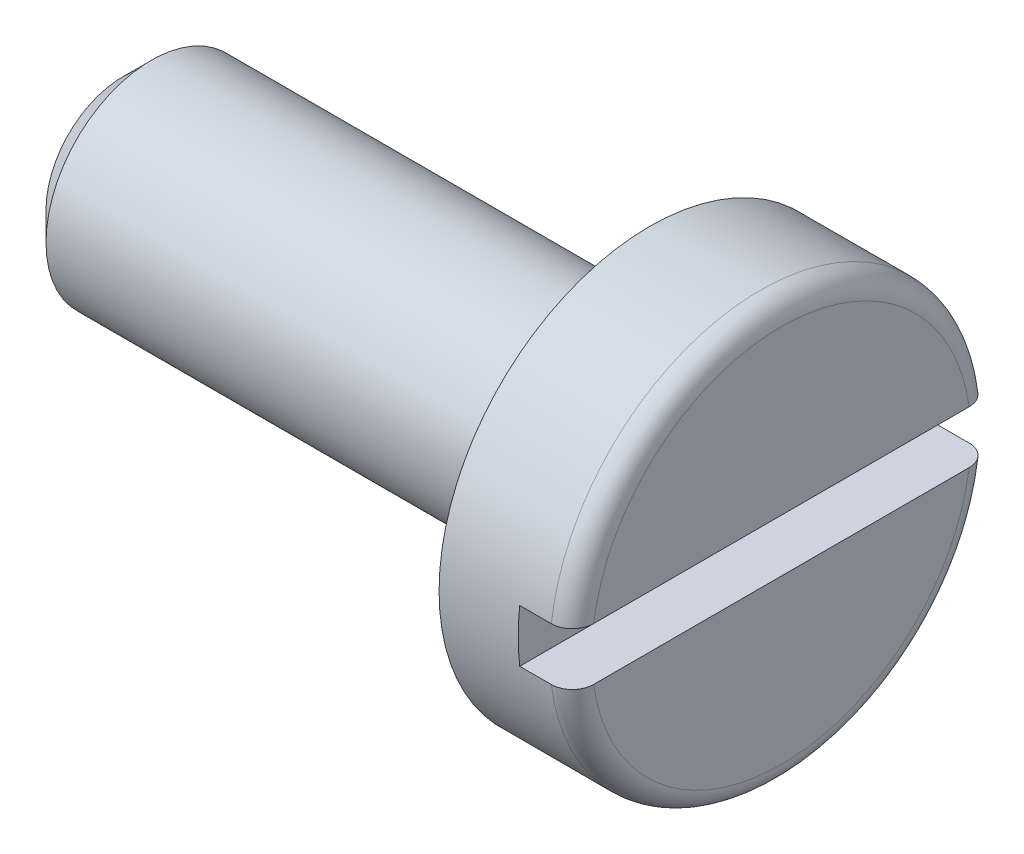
SolidWorks part; units mm, degrees
ref_plane "Plan de face" through (0, 0, 0) normal (0, 0, 1) x (1, 0, 0)
ref_plane "Plan de dessus" through (0, 0, 0) normal (0, 1, 0) x (1, 0, 0)
ref_plane "Plan de coté" through (0, 0, 0) normal (1, 0, 0) x (0, 0, -1)
sketch "Esquisse1" plane through (0, 0, 0) normal (0, 0, 1) x (1, 0, 0)
  line L0 (0, 0) -> (-17.1619, 0) construction
  line L1 (0, 0) -> (0, 1.44)
  line L2 (-0.16, 1.6) -> (-1, 1.6)
  line L3 (-1, 1.6) -> (-1, 0.8)
  line L4 (-1, 0.8) -> (-5, 0.8)
  line L5 (-5, 0.8) -> (-5, 0)
  line L6 (-5, 0) -> (0, 0)
  arc A0 (0, 1.44) -> (-0.16, 1.6) centre (-0.16, 1.44) ccw
  dimension "conge_tete" = 0.16
  dimension "diam_tete" = 3.2
  dimension "haut_tete" = 1
  dimension "longueur" = 4
  dimension "diametre" = 1.6
revolve "BaseRévolution" add sketch "Esquisse1" angle 360 about L0
chamfer "Chanfrein1" distance 0.2147 angle 45 1 edges at (-5, 0, -0.8)
sketch "Esquisse2" plane through (0, 0, 0) normal (1, 0, 0) x (0, 0, -1)
  line L0 (-1.6, 0.2) -> (1.6, 0.2)
  line L1 (-1.6, 0.2) -> (-1.6, -0.2)
  line L2 (1.6, -0.2) -> (-1.6, -0.2)
  line L3 (1.6, -0.2) -> (1.6, 0.2)
  circle A0 centre (0, 0) radius 1.6 construction
  dimension "larg_rainure" = 0.4
  dimension "D2" = 0.2
extrude "Enlèv. mat.-Extru.1" cut sketch "Esquisse2" against normal blind 0.4
equation "\"D2@Esquisse2\"=\"larg_rainure@Esquisse2\"/2"
equation "\"prof_rainure@Enlèv. mat.-Extru.1\"=\"larg_rainure@Esquisse2\""
